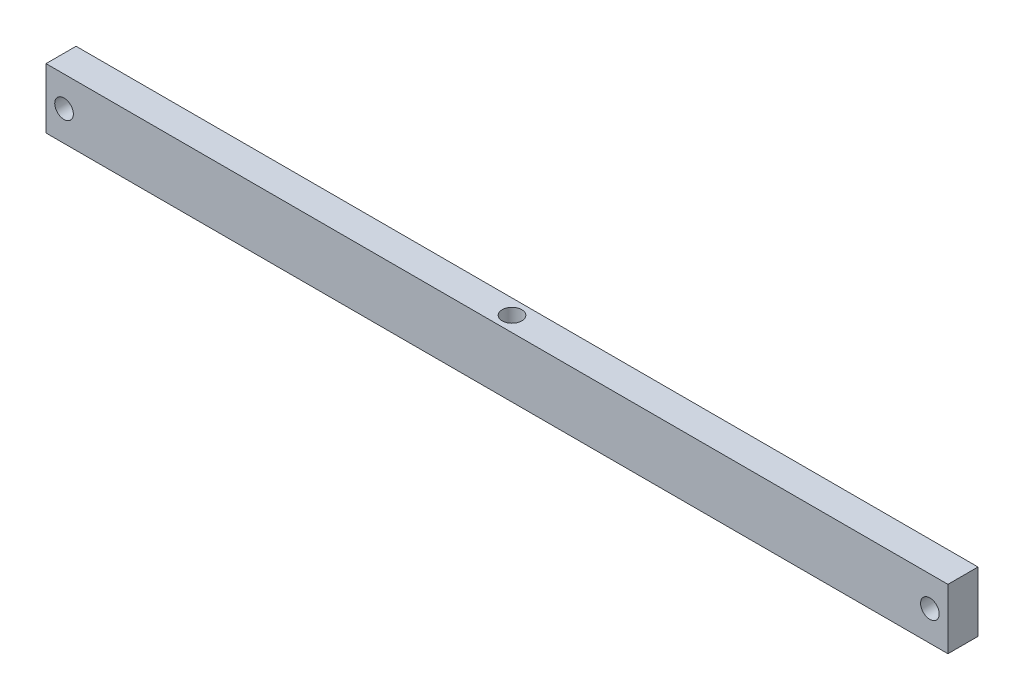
SolidWorks part; units mm, degrees
ref_plane "Plan de face" through (0, 0, 0) normal (0, 0, 1) x (1, 0, 0)
ref_plane "Plan de dessus" through (0, 0, 0) normal (0, 1, 0) x (1, 0, 0)
ref_plane "Plan de droite" through (0, 0, 0) normal (1, 0, 0) x (0, 0, -1)
sketch "Esquisse1" plane through (0, 0, 0) normal (0, 0, 1) x (1, 0, 0)
  line L0 (0, 0) -> (300, 0)
  line L1 (300, 0) -> (300, 20)
  line L2 (300, 20) -> (0, 20)
  line L3 (0, 20) -> (0, 0)
  line L4 (150, 0) -> (150, 14.8177) construction
  circle A0 centre (6, 10) radius 3.1
  circle A1 centre (294, 10) radius 3.1
  dimension "D3" = 6.2
  dimension "D1" = 20
  dimension "D2" = 300
  dimension "D4" = 6
  dimension "D5" = 10
extrude "Extrusion1" add sketch "Esquisse1" along normal mid plane 10
sketch "Esquisse2" plane through (0, 20, 0) normal (0, 1, 0) x (-1, 0, 0)
  circle A0 centre (-150, 0) radius 3.25
  dimension "D1" = 6.5
extrude "Enlèv. mat.-Extru.1" cut sketch "Esquisse2" against normal up to next
